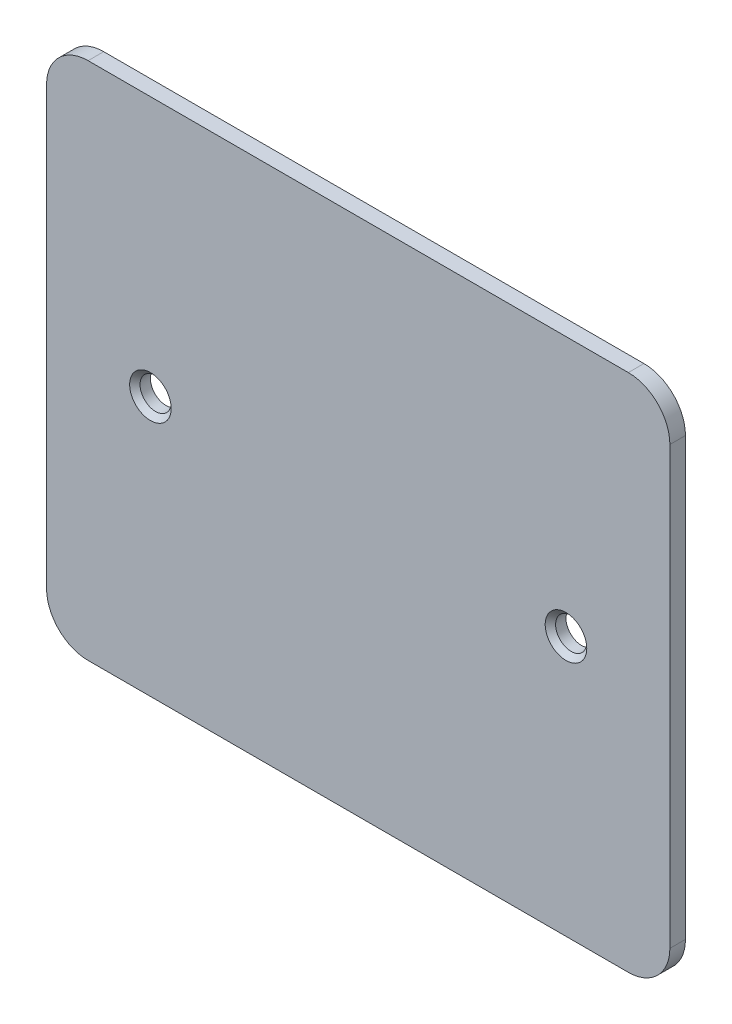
SolidWorks part; units mm, degrees
ref_plane "Plan de face" through (0, 0, 0) normal (0, 0, 1) x (1, 0, 0)
ref_plane "Plan de dessus" through (0, 0, 0) normal (0, 1, 0) x (1, 0, 0)
ref_plane "Plan de droite" through (0, 0, 0) normal (1, 0, 0) x (0, 0, -1)
sketch "Esquisse1" plane through (0, 0, 0) normal (0, 0, 1) x (1, 0, 0)
  line L0 (-60, 25) -> (-50, 25) construction
  line L1 (0, 0) -> (-60, 0)
  line L2 (0, 0) -> (0, 50)
  line L3 (0, 50) -> (-60, 50)
  line L4 (-60, 0) -> (-60, 50)
  line L5 (-50, 25) -> (-10, 25) construction
  line L6 (-10, 25) -> (0, 25) construction
  circle A0 centre (-50, 25) radius 1.5
  circle A1 centre (-10, 25) radius 1.5
  dimension "D5" = 3
  dimension "D1" = 60
  dimension "D2" = 50
  dimension "D3" = 10
  dimension "D4" = 10
extrude "Extrusion1" add sketch "Esquisse1" along normal blind 1.5
chamfer "Chanfrein1" distance 0.5 angle 45 2 edges at (-8.5, 25, 1.5) (-48.5, 25, 1.5)
fillet "Congé1" radius 4 4 edges at (-60, 0, 0.75) (0, 0, 0.75) (0, 50, 0.75) (-60, 50, 0.75)
